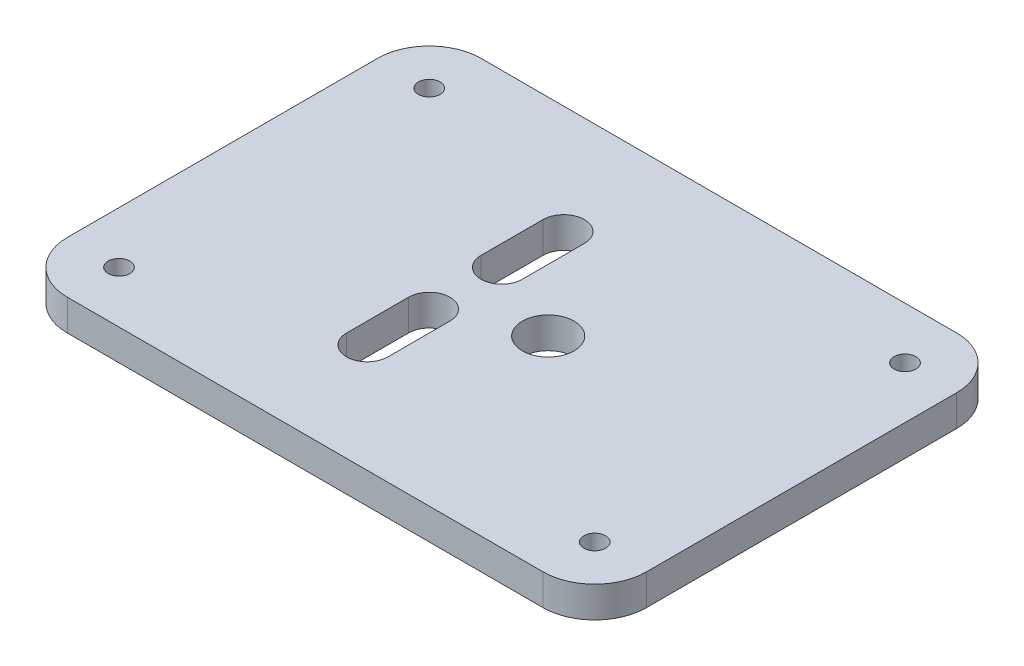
SolidWorks part; units mm, degrees
ref_plane "Front Plane" through (0, 0, 0) normal (0, 0, 1) x (1, 0, 0)
ref_plane "Top Plane" through (0, 0, 0) normal (0, 1, 0) x (1, 0, 0)
ref_plane "Right Plane" through (0, 0, 0) normal (1, 0, 0) x (0, 0, -1)
sketch "Sketch1" plane through (0, 0, 0) normal (0, 1, 0) x (1, 0, 0)
  line L0 (0, 40) -> (112, 40) construction
  line L1 (10, 0) -> (102, 0)
  line L2 (0, 10) -> (0, 70)
  line L3 (10, 80) -> (102, 80)
  line L4 (112, 10) -> (112, 70)
  line L5 (47, 80) -> (47, 0) construction
  line L6 (51, 59) -> (51, 47)
  line L7 (51, 33) -> (51, 21)
  line L8 (43, 21) -> (43, 33)
  line L9 (43, 47) -> (43, 59)
  circle A0 centre (63, 40) radius 5
  arc A1 (51, 59) -> (43, 59) centre (47, 59) ccw
  arc A2 (43, 47) -> (51, 47) centre (47, 47) ccw
  arc A3 (51, 33) -> (43, 33) centre (47, 33) ccw
  arc A4 (43, 21) -> (51, 21) centre (47, 21) ccw
  arc A5 (112, 70) -> (102, 80) centre (102, 70) ccw
  arc A6 (102, 0) -> (112, 10) centre (102, 10) ccw
  arc A7 (10, 0) -> (0, 10) centre (10, 10) cw
  arc A8 (0, 70) -> (10, 80) centre (10, 70) cw
  point P12 (-20.4161, 52.8231)
  point P18 (112, 80)
  point P31 (0, 0)
  point P34 (0, 80)
  dimension "D3" = 10
  dimension "D4" = 8
  dimension "D7" = 21
  dimension "D8" = 12
  dimension "D9" = 21
  dimension "D10" = 12
  dimension "D12" = 10
  dimension "D1" = 80
  dimension "D2" = 112
  dimension "D5" = 47
  dimension "D6" = 16
extrude "Extrude1" add sketch "Sketch1" along normal blind 6
sketch "Sketch2" plane through (0, 6, 0) normal (0, 1, 0) x (1, 0, 0)
  point P0 (102, 70)
  point P1 (102, 10)
  point P3 (10, 10)
  point P5 (10, 70)
hole_wizard "M5 Tapped Hole1" positions "3DSketch1" profile "Sketch3" tap size "M5" standard "ISO"
sketch3d "3DSketch1"
  point P0 (10, 6, -70)
  point P3 (102, 6, -70)
  point P6 (102, 6, -10)
  point P9 (10, 6, -10)
sketch "Sketch3" plane through (10, 6, -70) normal (1, 0, 0) x (0, 0, 1)
  line L0 (0, 0) -> (0, 6)
  line L1 (0, 6) -> (2.1, 6)
  line L2 (2.1, 6) -> (2.1, 0)
  line L5 (2.1, 0) -> (0, 0)
  line L11 (0, -6.35) -> (0, 107.95) construction
  dimension "Thru Tap Drill Dia." = 4.2
  dimension "Thru Tap Drill Depth" = 6
